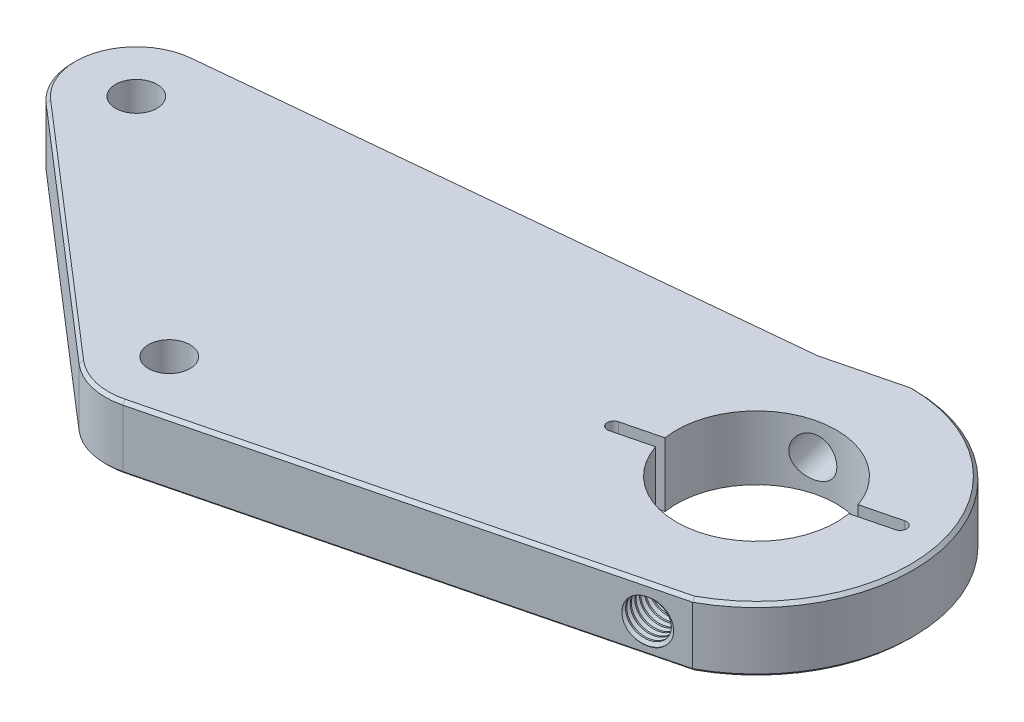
SolidWorks part; units mm, degrees
ref_plane "Front Plane" through (0, 0, 0) normal (0, 0, 1) x (1, 0, 0)
ref_plane "Top Plane" through (0, 0, 0) normal (0, 1, 0) x (1, 0, 0)
ref_plane "Right Plane" through (0, 0, 0) normal (1, 0, 0) x (0, 0, -1)
sketch "Sketch1" plane through (0, 0, 0) normal (0, 1, 0) x (1, 0, 0)
  line L0 (0, 0) -> (-169.7496, -42.545) construction
  line L2 (-230.6742, -135) -> (119.6327, -135) construction
  line L4 (-5, 9.2331) -> (5, 9.2331) construction
  line L5 (-5, 9.2331) -> (-5, -9.2331) construction
  line L6 (-5, -9.2331) -> (5, -9.2331) construction
  line L7 (5, 9.2331) -> (5, -9.2331) construction
  line L8 (-5, 9.2331) -> (5, -9.2331) construction
  line L9 (-5, -9.2331) -> (5, 9.2331) construction
  line L14 (-11.5949, 21.5826) -> (-100.9254, 12.8896)
  line L15 (-0.0451, -24.5) -> (-59.6882, -39.4485)
  line L16 (-106.4939, -4.6309) -> (-68.6564, -37.3161)
  line L17 (-138.5641, -80) -> (-87.5752, -20.9735) construction
  line L22 (-134.5822, -10.7605) -> (-58.9335, -76.1081) construction
  line L23 (-11.5949, 21.5826) -> (0.0451, 24.5)
  line L24 (-5.7749, 23.0413) -> (0, 0) construction
  line L25 (0, 0) -> (5.7749, -23.0413) construction
  line L26 (-0.0451, -24.5) -> (11.5949, -21.5826)
  line L28 (11.8146, 4.0823) -> (17.6346, 5.541)
  line L29 (-18.1634, -3.4312) -> (-12.3434, -1.9725)
  line L30 (12.3145, 2.1457) -> (18.1344, 3.6044)
  line L32 (-17.6908, -5.3746) -> (-11.8708, -3.9159)
  circle A0 centre (0, 0) radius 12.5 construction
  circle A1 centre (-138.5641, -80) radius 55 construction
  circle A2 centre (0, 0) radius 10.5 construction
  circle A9 centre (-99.9569, 2.9366) radius 3.25
  circle A10 centre (-62.1194, -29.7486) radius 3.25
  circle A11 centre (0, 0) radius 24.5 construction
  arc A13 (0.0451, 24.5) -> (11.5949, -21.5826) centre (0, 0) cw
  arc A16 (-12.3434, -1.9725) -> (11.8146, 4.0823) centre (0, 0) cw
  arc A17 (-11.8708, -3.9159) -> (12.3145, 2.1457) centre (0, 0) ccw
  arc A18 (-100.9254, 12.8896) -> (-106.4939, -4.6309) centre (-99.9569, 2.9366) ccw
  arc A19 (-59.6882, -39.4485) -> (-68.6564, -37.3161) centre (-62.1194, -29.7486) cw
  arc A20 (-17.6908, -5.3746) -> (-18.1634, -3.4312) centre (-17.9339, -4.4046) cw
  arc A21 (17.6346, 5.541) -> (18.1344, 3.6044) centre (17.8913, 4.5745) cw
  point P14 (0, 0)
  point P45 (5.7749, -23.0413)
  dimension "D1" = 110
  dimension "D2" = 25
  dimension "D4" = 2
  dimension "D9" = 12
  dimension "D15" = 10
  dimension "D16" = 50
  dimension "D8" = 6
  dimension "D22" = 2
  dimension "D21" = 23
  dimension "D7" = 6.5
  dimension "D3" = 135
  dimension "D5" = 10
  dimension "D6" = 18.4662
  dimension "D10" = 160
  dimension "D18" = 100
  dimension "D19" = 175
  dimension "D23" = 12
  dimension "D24" = 2
extrude "Boss-Extrude1" add sketch "Sketch1" along normal mid plane 10
sketch "Sketch2" plane through (-5.7749, 0, -23.0413) normal (-0.2431, 0, -0.97) x (-0.97, 0, 0.2431)
  line L4 (-6, -5) -> (6, -5)
  line L5 (6, -5) -> (6, 5)
  line L6 (6, 5) -> (-6, 5)
  line L7 (-6, 5) -> (-6, -5)
  line L8 (-6, -5) -> (6, -5) construction
  line L10 (6, 5) -> (-6, 5) construction
  line L12 (6, -5) -> (6, 5)
  line L13 (-6, 5) -> (-6, -5)
  circle A0 centre (0, 0) radius 3.1
  dimension "D2" = 6.2
  dimension "D1" = 0
extrude "Cut-Extrude1" cut sketch "Sketch2" against normal through all contours A0
chamfer "Chamfer1" distance 0.5 angle 45 14 edges at (23.7649, -5, -5.9563) (-24.0467, -5, 30.5156) (-56.2602, -5, -17.2361) (-5.7749, -5, -23.0413) (-5.7749, 5, -23.0413) (-56.2602, 5, -17.2361) (-24.0467, 5, 30.5156) (23.7649, 5, -5.9563) (-64.4327, -5, 39.4773) (-87.5752, -5, 20.9735) (-109.4871, -5, -5.9656) (-109.4871, 5, -5.9656) (-87.5752, 5, 20.9735) (-64.4327, 5, 39.4773)
thread "Thread1" pitch 1 start angle 0, offset 2, length 19, pitch 1, diameter 6.2
ref_plane "Plane1" through (3.2542, 0, 25.7349) normal (0, -1, 0) x (-0.97, 0, 0.2431)
sketch "Thread Profile1" plane through (3.2542, 0, 25.7349) normal (0, -1, 0) x (-0.97, 0, 0.2431)
  line L0 (0, 0) -> (0, 1) construction
  line L1 (0, 0) -> (0.5413, 0.3125)
  line L2 (0.5413, 0.3125) -> (0.5413, 0.4375)
  line L3 (0.5413, 0.4375) -> (0, 0.75)
  line L4 (0.5413, 0.375) -> (0, 0.375) construction
  line L11 (0, 0) -> (0, 0.75)
  point P2 (0, 0)
  dimension "Pitch" = 1
  dimension "Profile_Angle" = 60
  dimension "Profile_Land" = 0.125
  dimension "Profile_Height" = 0.5413
